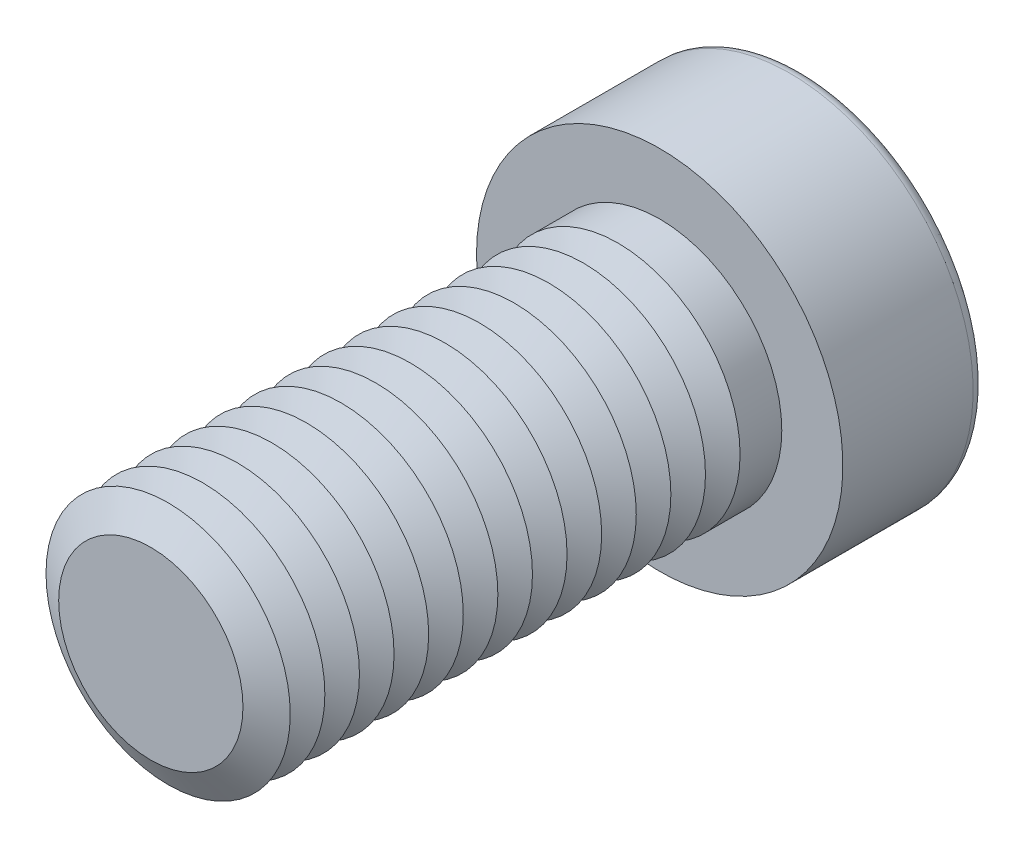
SolidWorks part; units mm, degrees
ref_plane "Front Plane" through (0, 0, 0) normal (0, 0, 1) x (1, 0, 0)
ref_plane "Top Plane" through (0, 0, 0) normal (0, 1, 0) x (1, 0, 0)
ref_plane "Right Plane" through (0, 0, 0) normal (1, 0, 0) x (0, 0, -1)
sketch "Sketch1" plane through (0, 0, 0) normal (0, 0, 1) x (1, 0, 0)
  circle A0 centre (0, 0) radius 6
  dimension "D1" = 12
extrude "Boss-Extrude1" add sketch "Sketch1" along normal blind 25
sketch "Sketch2" plane through (0, 0, 0) normal (0, 0, -1) x (-1, 0, 0)
  circle A0 centre (0, 0) radius 9
  dimension "D1" = 18
extrude "Boss-Extrude2" add sketch "Sketch2" along normal blind 7
sketch "Sketch3" plane through (0, 0, -7) normal (0, 0, -1) x (-1, 0, 0)
  line L1 (-2.3094, 4) -> (-4.6188, 0)
  line L2 (-4.6188, 0) -> (-2.3094, -4)
  line L3 (-2.3094, -4) -> (2.3094, -4)
  line L4 (2.3094, -4) -> (4.6188, 0)
  line L5 (4.6188, 0) -> (2.3094, 4)
  line L6 (2.3094, 4) -> (-2.3094, 4)
  circle A0 centre (0, 0) radius 4 construction
  dimension "D1" = 8
extrude "Cut-Extrude1" cut sketch "Sketch3" against normal blind 6
fillet "Fillet1" radius 0.6 1 edges at (-9, 0, -7)
sketch "Sketch4" plane through (0, 0, -1) normal (0, 0, -1) x (-1, 0, 0)
  line L0 (2.3094, -4) -> (4.6188, 0) construction
  circle A0 centre (0, 0) radius 4
extrude "Cut-Extrude2" cut sketch "Sketch4" against normal through all draft 60
sketch "Sketch5" plane through (0, 0, -7) normal (0, 0, -1) x (-1, 0, 0)
  circle A0 centre (0, 0) radius 4.6188
extrude "Cut-Extrude3" cut sketch "Sketch5" against normal through all draft 75
sketch "Sketch7" plane through (0, 0, 0) normal (1, 0, 0) x (0, 0, -1)
  line L25 (-25, 4.5278) -> (-24.15, 6)
  line L26 (-25, 6) -> (-25, -6) construction
  line L27 (-24.15, 6) -> (-25.85, 6)
  line L28 (-25.85, 6) -> (-25, 4.5278)
  line L29 (0, 6) -> (-25, 6) construction
  dimension "D1" = 1.7
revolve "Cut-Revolve1" cut sketch "Sketch7" angle 360 about axis through (0, 0, 25) along (0, 0, -1)
pattern_linear "LPattern1" count 14 spacing 1.7 along (0, 0, -1) of "Cut-Revolve1"
